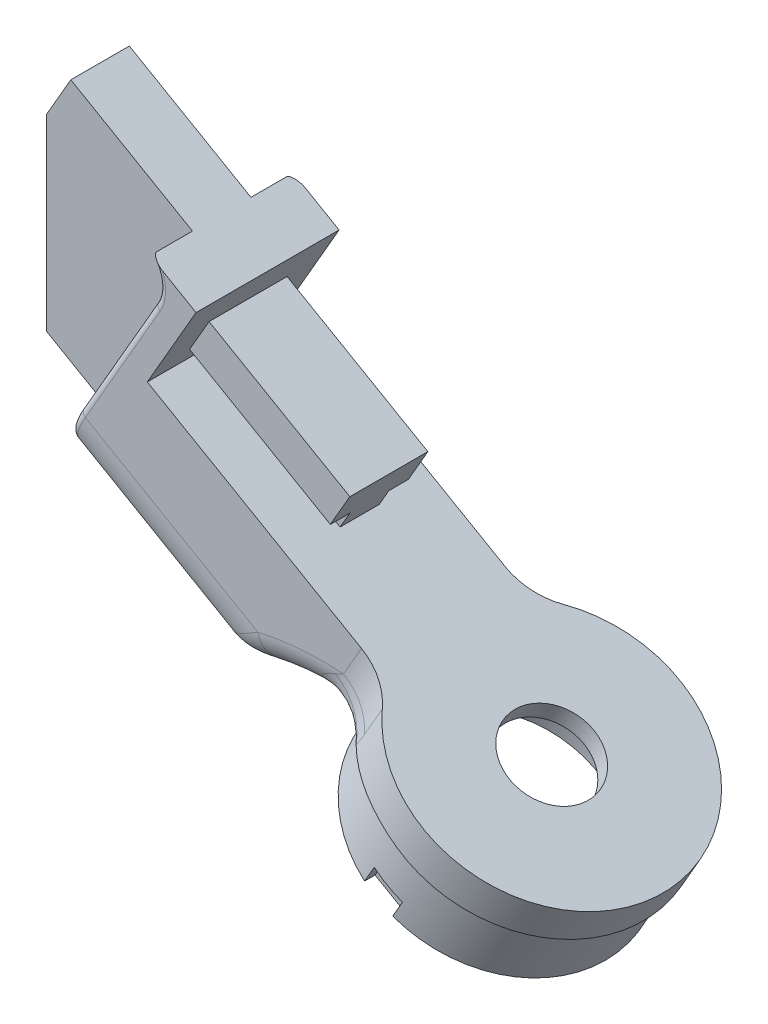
SolidWorks part; units mm, degrees
ref_plane "Front Plane" through (0, 0, 0) normal (0, 0, 1) x (1, 0, 0)
ref_plane "Top Plane" through (0, 0, 0) normal (0, 1, 0) x (1, 0, 0)
ref_plane "Right Plane" through (0, 0, 0) normal (1, 0, 0) x (0, 0, -1)
sketch "Sketch1" plane through (0, 0, 0) normal (0, 0, 1) x (1, 0, 0)
  line L0 (28.0039, 73.0571) -> (28.0039, 101.9246)
  line L1 (28.0039, 101.9246) -> (31.7539, 108.4198)
  line L2 (31.7539, 108.4198) -> (53.621, 95.7948)
  line L3 (53.621, 95.7948) -> (37.371, 67.649)
  line L4 (28.0039, 73.0571) -> (37.371, 67.649)
  point P5 (37.1545, 67.774)
  dimension "D1" = 0.25
extrude "Boss-Extrude1" add sketch "Sketch1" along normal blind 9
sketch "Sketch2" plane through (28.0039, 0, 0) normal (-1, 0, 0) x (0, 0, 1)
  line L2 (0, 90.9246) -> (9, 90.9246) construction
  line L3 (0, 101.9246) -> (0, 73.0571) construction
  line L4 (9, 101.9246) -> (9, 73.0571) construction
  line L5 (9, 101.9246) -> (0, 101.9246) construction
  circle A0 centre (4.5, 90.9246) radius 3.5
  dimension "D1" = 7
  dimension "D2" = 11
extrude "Cut-Extrude1" cut sketch "Sketch2" against normal blind 15
sketch "Sketch3" plane through (-1.2646, 0.7301, 0) normal (0.866, -0.5, 0) x (0, 0, -1)
  line L0 (-9, 77.2712) -> (-9, 109.7712) construction
  line L2 (-3.5, 71.7712) -> (-5.5, 71.7712)
  line L3 (-15.5, 81.7712) -> (-15.5, 109.7712)
  line L4 (-15.5, 109.7712) -> (6.5, 109.7712)
  line L5 (0, 77.2712) -> (0, 109.7712) construction
  line L6 (6.5, 109.7712) -> (6.5, 81.7712)
  line L7 (-9, 109.7712) -> (0, 109.7712) construction
  line L8 (-9, 77.2712) -> (0, 77.2712) construction
  arc A4 (-3.5, 71.7712) -> (6.5, 81.7712) centre (-3.5, 81.7712) ccw
  arc A5 (-15.5, 81.7712) -> (-5.5, 71.7712) centre (-5.5, 81.7712) ccw
  dimension "D1" = 10
  dimension "D2" = 10
  dimension "D3" = 2
  dimension "D4" = 6.5
  dimension "D5" = 6.5
  dimension "D6" = 4.5
  dimension "D7" = 5.5
extrude "Boss-Extrude2" add sketch "Sketch3" along normal blind 4.5
sketch "Sketch4" plane through (0, 0, 9) normal (0, 0, 1) x (1, 0, 0)
  line L0 (51.121, 91.4647) -> (53.621, 95.7948)
  line L1 (53.621, 95.7948) -> (50.4607, 97.6194)
  line L3 (37.371, 67.649) -> (53.621, 95.7948) construction
  line L4 (53.621, 95.7948) -> (31.7539, 108.4198) construction
  arc A3 (51.121, 91.4647) -> (50.4607, 97.6194) centre (46.5744, 94.0897) ccw
  dimension "D1" = 5.25
  dimension "D2" = 5
extrude "Boss-Extrude3" add sketch "Sketch4" along normal up to surface (6.5 mm away)
sketch "Sketch6" plane through (0, 0, 0) normal (0, 0, -1) x (-1, 0, 0)
  line L0 (-53.621, 95.7948) -> (-50.4607, 97.6194) construction
  line L1 (-51.121, 91.4647) -> (-53.621, 95.7948) construction
  line L2 (-53.621, 95.7948) -> (-50.4607, 97.6194)
  line L3 (-51.121, 91.4647) -> (-53.621, 95.7948)
  arc A0 (-50.4607, 97.6194) -> (-51.121, 91.4647) centre (-46.5744, 94.0897) ccw construction
  arc A1 (-50.4607, 97.6194) -> (-51.121, 91.4647) centre (-46.5744, 94.0897) ccw
extrude "Boss-Extrude4" add sketch "Sketch6" along normal up to surface (6.5 mm away)
fillet "Fillet1" radius 1 7 edges at (51.7944, 94.6497, 15.5) (45.371, 81.5054, 15.5) (36.0855, 65.4223, 12.5711) (34.621, 62.8858, 4.5) (51.7944, 94.6497, -6.5) (45.371, 81.5054, -6.5) (36.0855, 65.4223, -3.5711)
sketch "Sketch7" plane through (2.6325, -1.5199, 0) normal (0.866, -0.5, 0) x (0, 0, -1)
  line L0 (-10.5, 103.7712) -> (-10.5, 97.7712)
  line L1 (-10.5, 97.7712) -> (-7.5, 97.7712)
  line L2 (-7.5, 97.7712) -> (-7.5, 94.7712)
  line L3 (-7.5, 94.7712) -> (-15.5, 94.7712)
  line L4 (-10.5, 100.7712) -> (1.5, 100.7712) construction
  line L5 (-15.5, 109.7712) -> (-15.5, 81.7712) construction
  line L7 (6.5, 109.7712) -> (-15.5, 109.7712) construction
  line L9 (-15.5, 94.7712) -> (-15.5, 81.7712)
  line L10 (-1.5, 94.7712) -> (6.5, 94.7712)
  line L11 (-1.5, 97.7712) -> (-1.5, 94.7712)
  line L12 (1.5, 97.7712) -> (-1.5, 97.7712)
  line L13 (1.5, 103.7712) -> (1.5, 97.7712)
  line L15 (1.5, 103.7712) -> (-10.5, 103.7712)
  line L17 (-4.5, 109.7712) -> (-4.5, 71.7712) construction
  line L18 (-1.5, 96.2712) -> (-7.5, 96.2712) construction
  line L22 (6.5, 81.7712) -> (6.5, 109.7712)
  line L23 (6.5, 109.7712) -> (-15.5, 109.7712)
  line L24 (-15.5, 109.7712) -> (-15.5, 81.7712)
  line L25 (-5.5, 71.7712) -> (-3.5, 71.7712)
  line L26 (6.5, 81.7712) -> (6.5, 94.7712)
  line L29 (-5.5, 71.7712) -> (-3.5, 71.7712)
  arc A6 (-3.5, 71.7712) -> (6.5, 81.7712) centre (-3.5, 81.7712) ccw
  arc A7 (-15.5, 81.7712) -> (-5.5, 71.7712) centre (-5.5, 81.7712) ccw
  arc A8 (-3.5, 71.7712) -> (6.5, 81.7712) centre (-3.5, 81.7712) ccw
  arc A9 (-15.5, 81.7712) -> (-5.5, 71.7712) centre (-5.5, 81.7712) ccw
  point P23 (-4.5, 103.7712)
  point P28 (-4.5, 96.2712)
  point P33 (-4.5, 100.7712)
  dimension "D1" = 3
  dimension "D2" = 6
  dimension "D3" = 0
  dimension "D4" = 6
  dimension "D5" = 15
  dimension "D6" = 12
extrude "Boss-Extrude5" add sketch "Sketch7" along normal blind 25
sketch "Sketch8" plane through (47.3856, 82.0743, 0) normal (0.5, 0.866, 0) x (0.866, -0.5, 0)
  line L0 (28.0398, 6.5) -> (42.4052, 6.5)
  line L1 (42.4052, 6.5) -> (42.4052, -15.5) construction
  line L2 (42.4052, -15.5) -> (28.0398, -15.5)
  line L3 (28.0398, -15.5) -> (3.0398, -15.5) construction
  line L5 (42.4052, -4.5) -> (62.1552, -4.5) construction
  line L6 (42.4052, 6.5) -> (45.7521, 6.5)
  line L7 (42.4052, -15.5) -> (45.7521, -15.5)
  line L8 (28.0398, 6.5) -> (28.0398, -15.5)
  circle A0 centre (62.1552, -4.5) radius 19.75 construction
  arc A1 (45.7521, -15.5) -> (45.7521, 6.5) centre (62.1552, -4.5) ccw
  circle A2 centre (62.1552, -4.5) radius 6.5
  dimension "D1" = 39.5
  dimension "D3" = 13
extrude "Boss-Extrude6" add sketch "Sketch8" against normal blind 6
sketch "Sketch10" plane through (44.3856, 76.8781, 0) normal (-0.5, -0.866, 0) x (0.866, -0.5, 0)
  circle A0 centre (62.1552, 4.5) radius 6.5
  circle A1 centre (62.1552, 4.5) radius 6.5 construction
  circle A2 centre (62.1552, 4.5) radius 18.7846
extrude "Boss-Extrude7" add sketch "Sketch10" along normal blind 10
sketch "Sketch11" plane through (39.3856, 68.2179, 0) normal (-0.5, -0.866, 0) x (0.866, -0.5, 0)
  circle A0 centre (62.1552, 4.5) radius 15.0812
  dimension "D1" = 30.1625
extrude "Cut-Extrude2" cut sketch "Sketch11" against normal offset from surface (13 mm away) 3
fillet "Fillet2" radius 40 1 edges
fillet "Fillet3" radius 5 5 edges at (78.2469, 51.8351, -6.5) (63.8612, 49.6311, -3.7771) (60.1688, 48.1358, 4.5) (78.2469, 51.8351, 15.5) (61.9009, 48.8907, 10.7996)
fillet "Fillet4" radius 10 4 edges at (82.1702, 52.8127, -4.8434) (82.5497, 53.0996, 14.1806) (86.1134, 57.6487, -6.5) (86.1134, 57.6487, 15.5)
sketch "Sketch12" plane through (39.3856, 68.2179, 0) normal (-0.5, -0.866, 0) x (0.866, -0.5, 0)
  line L0 (62.1552, 21.5) -> (62.1552, -12.5) construction
  line L1 (59.6552, 23.5) -> (64.6552, 23.5)
  line L2 (59.6552, 23.5) -> (59.6552, 21.5)
  line L3 (59.6552, 21.5) -> (64.6552, 21.5)
  line L4 (64.6552, 23.5) -> (64.6552, 21.5)
  line L5 (62.1552, 4.5) -> (43.3706, 4.5) construction
  line L6 (64.6552, -14.5) -> (64.6552, -12.5)
  line L7 (59.6552, -12.5) -> (64.6552, -12.5)
  line L8 (59.6552, -14.5) -> (59.6552, -12.5)
  line L9 (59.6552, -14.5) -> (64.6552, -14.5)
  arc A0 (60.7659, 23.2331) -> (60.7659, -14.2331) centre (62.1552, 4.5) ccw construction
  circle A1 centre (62.1552, 4.5) radius 18.7846 construction
  dimension "D2" = 17
  dimension "D1" = 5
  dimension "D3" = 2
extrude "Cut-Extrude3" cut sketch "Sketch12" against normal blind 3
fillet "Fillet5" radius 1.5 2 edges at (94.7136, 39.7384, -12.5) (94.7136, 39.7384, 21.5)
